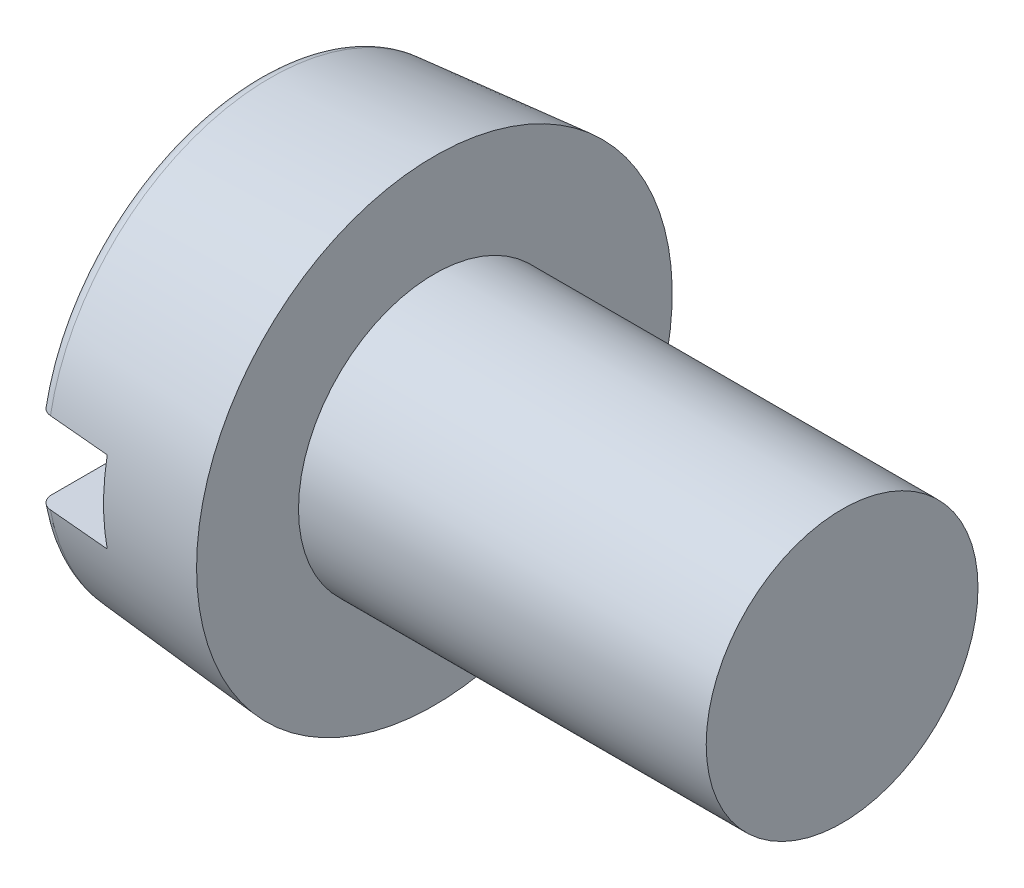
SolidWorks part; units mm, degrees
ref_plane "Plane1" through (0, 0, 0) normal (0, 0, 1) x (1, 0, 0)
ref_plane "Plane2" through (0, 0, 0) normal (0, 1, 0) x (1, 0, 0)
ref_plane "Plane3" through (0, 0, 0) normal (1, 0, 0) x (0, 0, -1)
sketch "BodySke" plane through (0, 0, 0) normal (0, 0, 1) x (1, 0, 0)
  line L0 (2.6, 2) -> (2.6, 3.5)
  line L1 (0, 0) -> (0, 3.2725)
  line L2 (-25.4, 0) -> (127, 0) construction
  line L3 (8.6, 0) -> (0, 0)
  line L4 (2.6, 2) -> (8.6, 2)
  line L5 (8.6, 2) -> (8.6, 0)
  line L6 (0, 3.2725) -> (2.6, 3.5)
  line L9 (3.3, 3.5875) -> (3.3, -5.9375) construction
  line L10 (2.6, 6.35) -> (2.6, -3.175) construction
  dimension "Head_ht" = 2.6
  dimension "Diameter" = 4
  dimension "Length" = 6
  dimension "Head_dia" = 7
  dimension "Advance" = 0.7
  dimension "Thread_nom" = 6
  dimension "Head_side_angle" = 5
revolve "Base-Revolve" add sketch "BodySke"
fillet "Fillet1" [suppressed] radius 0.2
fillet "Fillet2" radius 0.2 1 edges at (0, 0, 3.2725)
sketch "Sketch2" plane through (0, 0, 0) normal (1, 0, 0) x (0, 0, -1)
  line L0 (3.5, -0.6) -> (-3.5, -0.6)
  line L1 (3.5, -0.6) -> (3.5, 0.6)
  line L2 (-3.5, 0.6) -> (3.5, 0.6)
  line L3 (-3.5, 0.6) -> (-3.5, -0.6)
  dimension "D1" = 7
  dimension "D2" = 3.5
  dimension "Slot_width" = 1.2
  dimension "D3" = 0.6
extrude "Slot" cut sketch "Sketch2" along normal blind 1.1
sketch "ThdSchSke" plane through (0, 0, 0) normal (0, 0, 1) x (1, 0, 0)
  line L0 (4, -1.61) -> (3.7269, -2)
  line L1 (4, -1.61) -> (4.2731, -2)
  line L2 (4.2731, -2) -> (4.2731, -2.5)
  line L3 (-3.175, 0) -> (5.1513, 0) construction
  line L5 (4.2731, -2.5) -> (3.7269, -2.5)
  line L6 (3.7269, -2.5) -> (3.7269, -2)
  dimension "Thread_minor" = 3.22
  dimension "Diameter" = 4
  dimension "Start" = 4
  dimension "SideAngle" = 55
  dimension "VeeAngle" = 70
  dimension "Overcut" = 5
revolve "ThreadSchematic" [suppressed] cut sketch "ThdSchSke" angle 360 about L3
pattern_linear "ThdSchPat" [suppressed]
sketch "Sketch3" plane through (8.6, 0, 0) normal (1, 0, 0) x (0, 0, -1)
  point P0 (0, 0)
equation "\"D1@Sketch2\" = \"Head_dia@BodySke\""
equation "\"D2@Sketch2\" = \"D1@Sketch2\" / 2"
equation "\"D3@Sketch2\" = \"Slot_width@Sketch2\" / 2"
equation "\"Thread_length@ThreadCosmetic\" = ((sgn( (\"Length@BodySke\" - \"Advance@BodySke\" * 2.0 ) - \"Thread_nom@BodySke\" )-1)*( (\"Length@BodySke\" - \"Advance@BodySke\"  * 2.0) - \"Thread_nom@BodySke\" ))/-2+ \"Thread_"
equation "\"Thread_minor@ThdSchSke\" = \"Thread_minor@ThreadCosmetic\""
equation "\"Diameter@ThdSchSke\" = \"Diameter@BodySke\""
equation "\"Overcut@ThdSchSke\" = \"Diameter@BodySke\" * 1.25"
equation "\"Start@ThdSchSke\" = \"Head_ht@BodySke\" + \"Length@BodySke\" - \"Thread_length@ThreadCosmetic\"  '---Non-countersunk---"
equation "\"Num_threads@ThdSchPat\" = int( \"Thread_length@ThreadCosmetic\" / \"Advance@BodySke\" + 0.999 )  + 1"
equation "\"Advance@ThdSchPat\" = \"Thread_length@ThreadCosmetic\" /  (\"Num_threads@ThdSchPat\" - 1) 'relax it"
